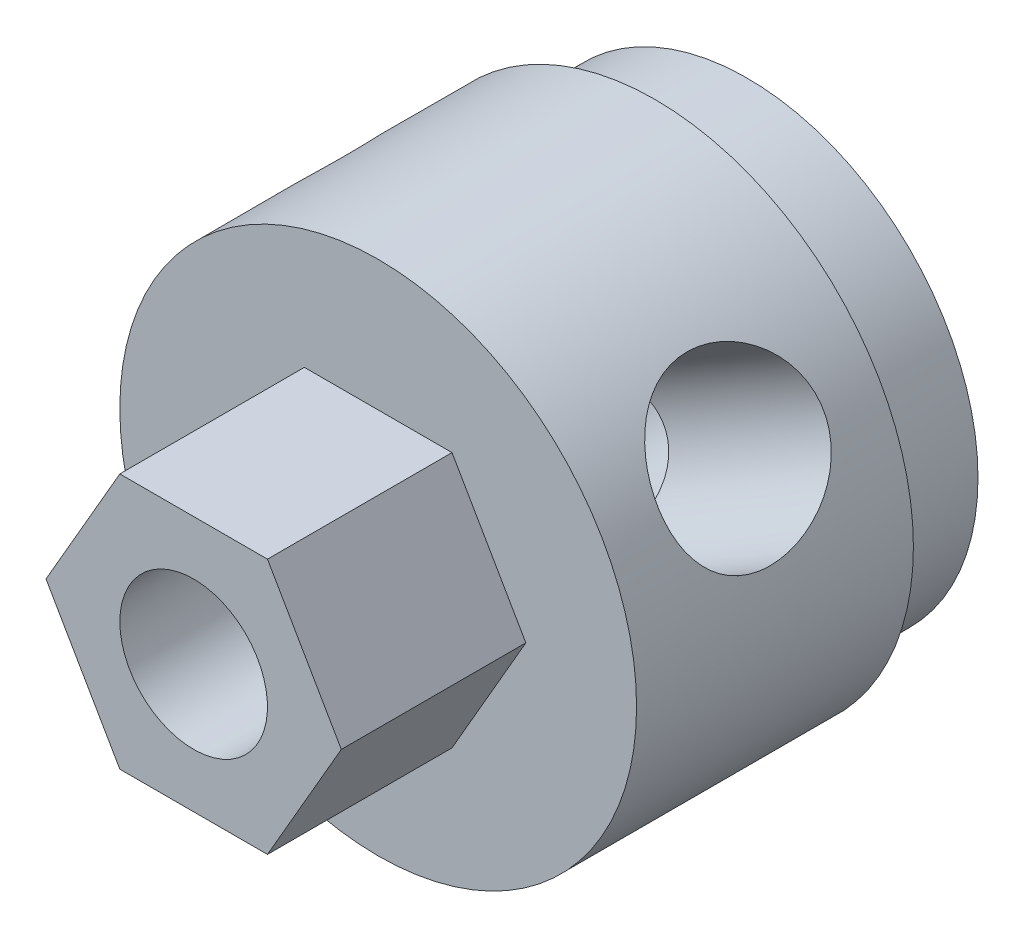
SolidWorks part; units mm, degrees
ref_plane "Front Plane" through (0, 0, 0) normal (0, 0, 1) x (1, 0, 0)
ref_plane "Top Plane" through (0, 0, 0) normal (0, 1, 0) x (1, 0, 0)
ref_plane "Right Plane" through (0, 0, 0) normal (1, 0, 0) x (0, 0, -1)
sketch "Sketch1" plane through (0, 0, 0) normal (0, 0, 1) x (1, 0, 0)
  circle A0 centre (0, 0) radius 3.175
  dimension "D1" = 6.35
extrude "Boss-Extrude1" add sketch "Sketch1" along normal blind 5.08
sketch "Sketch2" plane through (0, 0, 5.08) normal (0, 0, 1) x (1, 0, 0)
  line L1 (2.032, 0) -> (1.016, 1.7598)
  line L2 (1.016, 1.7598) -> (-1.016, 1.7598)
  line L3 (-1.016, 1.7598) -> (-2.032, 0)
  line L4 (-2.032, 0) -> (-1.016, -1.7598)
  line L5 (-1.016, -1.7598) -> (1.016, -1.7598)
  line L6 (1.016, -1.7598) -> (2.032, 0)
  circle A0 centre (0, 0) radius 1.7598 construction
  dimension "D1" = 4.064
extrude "Boss-Extrude2" add sketch "Sketch2" along normal blind 2.54
sketch "Sketch5" plane through (0, 0, 5.08) normal (0, 0, 1) x (1, 0, 0)
  circle A0 centre (0, 0) radius 3.175
  circle A1 centre (0, 0) radius 3.556
  dimension "D1" = 6.35
  dimension "D2" = 7.112
extrude "Boss-Extrude3" add sketch "Sketch5" against normal blind 3.81
sketch "Sketch7" plane through (0, 0, 0) normal (0, 0, -1) x (-1, 0, 0)
  circle A0 centre (0, 0) radius 1.016
  dimension "D1" = 2.032
extrude "Cut-Extrude1" cut sketch "Sketch7" against normal through all
sketch "Sketch8" plane through (0, 0, 0) normal (0, 1, 0) x (1, 0, 0)
  line L2 (3.175, 0) -> (-3.175, 0) construction
  circle A1 centre (0, -3.175) radius 1.143
  dimension "D1" = 3.175
  dimension "D2" = 2.286
extrude "Cut-Extrude2" cut sketch "Sketch8" against normal through all
pattern_circular "CirPattern1" count 3 every 120 about axis through (0, 0, 7.62) along (0, 0, -1) of "Cut-Extrude2"
